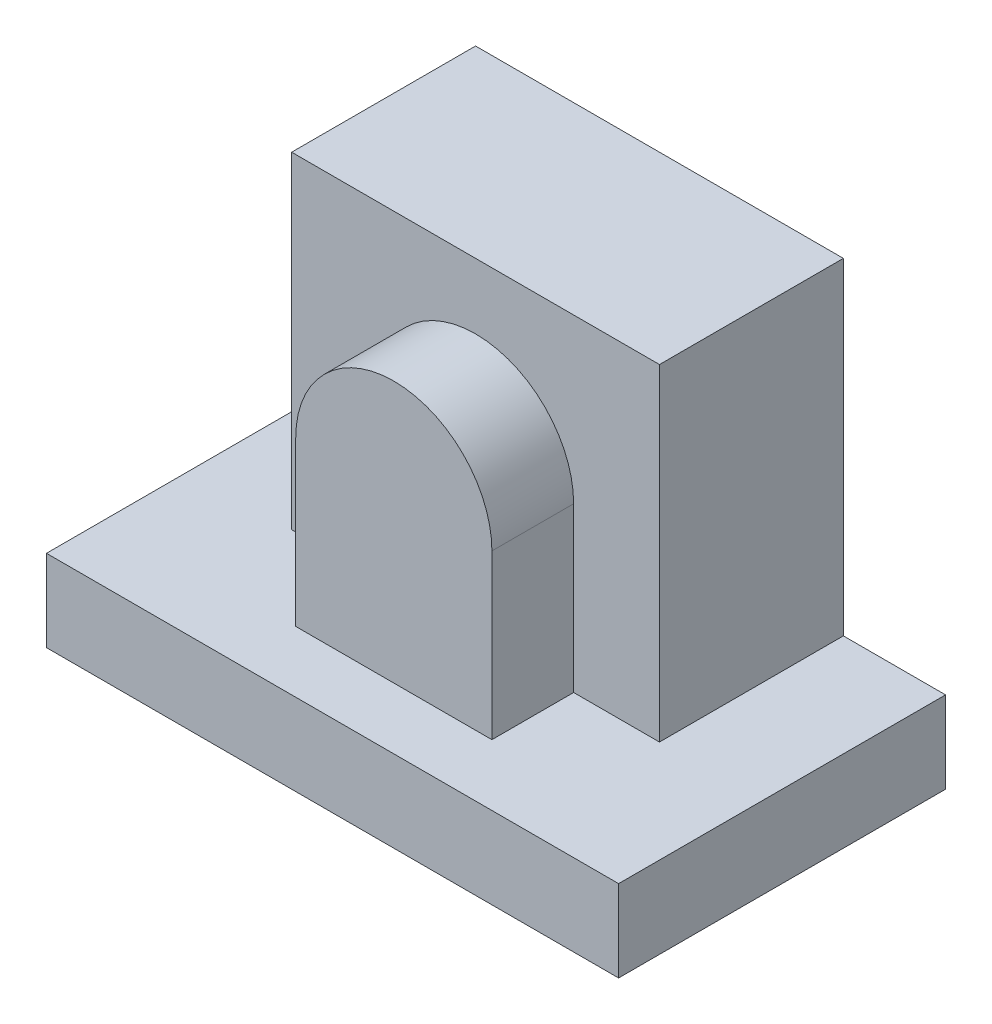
SolidWorks part; units mm, degrees
ref_plane "前视基准面" through (0, 0, 0) normal (0, 0, 1) x (1, 0, 0)
ref_plane "上视基准面" through (0, 0, 0) normal (0, 1, 0) x (1, 0, 0)
ref_plane "右视基准面" through (0, 0, 0) normal (1, 0, 0) x (0, 0, -1)
sketch "草图1" plane through (0, 0, 0) normal (0, 1, 0) x (1, 0, 0)
  line L0 (0, 0) -> (0, -101.1621) construction
  line L1 (-70, 0) -> (70, 0)
  line L2 (-70, 0) -> (-70, -80)
  line L3 (-70, -80) -> (70, -80)
  line L4 (70, 0) -> (70, -80)
  dimension "D1" = 140
  dimension "D2" = 80
extrude "拉伸1" add sketch "草图1" along normal blind 20
sketch "草图2" plane through (0, 20, 0) normal (0, 1, 0) x (1, 0, 0)
  line L0 (70, 0) -> (-70, 0) construction
  line L1 (-45, 0) -> (45, 0)
  line L2 (-45, 0) -> (-45, -45)
  line L3 (-45, -45) -> (45, -45)
  line L4 (45, 0) -> (45, -45)
  line L5 (0, 0) -> (0, -65.2554) construction
  dimension "D1" = 90
  dimension "D2" = 45
extrude "拉伸2" add sketch "草图2" along normal blind 80
sketch "草图3" plane through (0, 0, 45) normal (0, 0, 1) x (1, 0, 0)
  line L0 (0, 0) -> (0, 113.4739) construction
  line L1 (24, 20) -> (-24, 20)
  line L2 (-70, 20) -> (70, 20) construction
  line L3 (-45, 20) -> (45, 20) construction
  line L4 (-24, 20) -> (-24, 60)
  line L5 (24, 60) -> (24, 20)
  arc A0 (-24, 60) -> (24, 60) centre (0, 60) cw
  dimension "D1" = 24
  dimension "D2" = 40
extrude "拉伸3" add sketch "草图3" along normal blind 20
